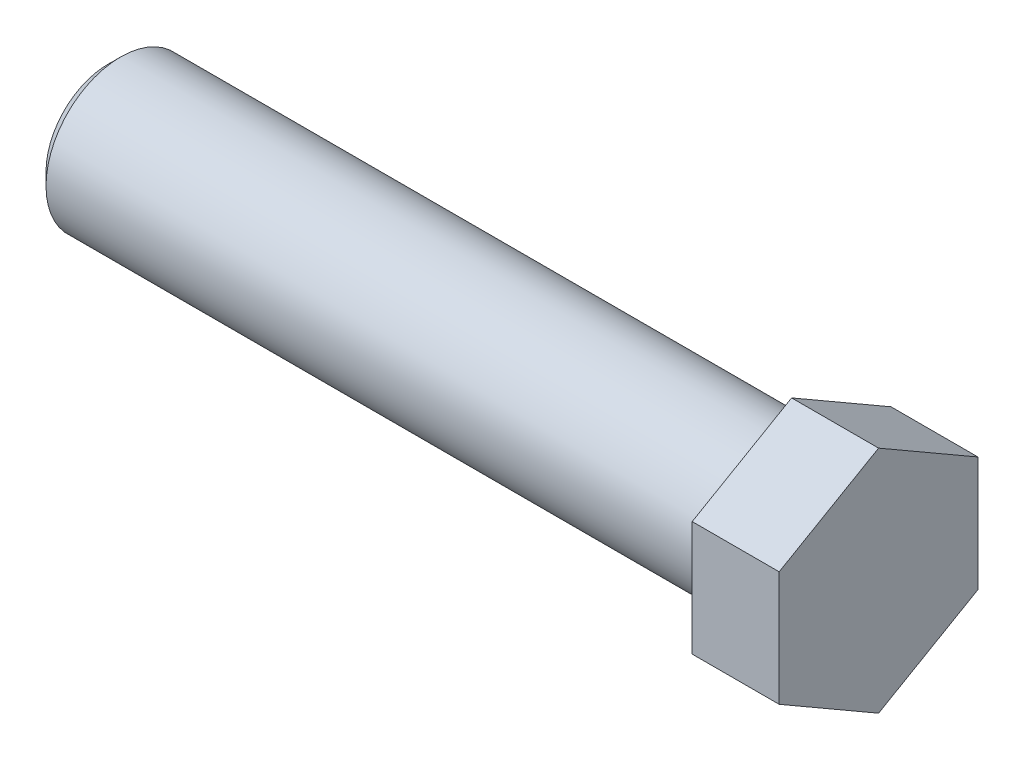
SolidWorks part; units mm, degrees
ref_plane "Plan1" through (0, 0, 0) normal (0, 0, 1) x (1, 0, 0)
ref_plane "Plan2" through (0, 0, 0) normal (0, 1, 0) x (1, 0, 0)
ref_plane "Plan3" through (0, 0, 0) normal (1, 0, 0) x (0, 0, -1)
sketch "Esquisse1" plane through (0, 0, 0) normal (0, 0, 1) x (1, 0, 0)
  line L0 (30, 0) -> (-110, 0) construction
  line L1 (0, 0) -> (-55, 0)
  line L2 (0, 0) -> (0, 6)
  line L3 (0, 6) -> (-55, 6)
  line L4 (-55, 0) -> (-55, 6)
  dimension "D1" = 6
  dimension "D2" = 55
revolve "Base-Révolution" add sketch "Esquisse1" angle 360 about L0
chamfer "Chanfrein1" distance 1 angle 45
sketch "Esquisse2" plane through (0, 0, 0) normal (1, 0, 0) x (0, 0, -1)
  line L0 (8, -4.6188) -> (8, 4.6188)
  line L1 (0, -9.2376) -> (8, -4.6188)
  line L2 (-8, -4.6188) -> (0, -9.2376)
  line L3 (-8, 4.6188) -> (-8, -4.6188)
  line L4 (0, 9.2376) -> (-8, 4.6188)
  line L5 (8, 4.6188) -> (0, 9.2376)
  dimension "D1" = 8
extrude "Boss.-Extru.1" add sketch "Esquisse2" along normal blind 7
